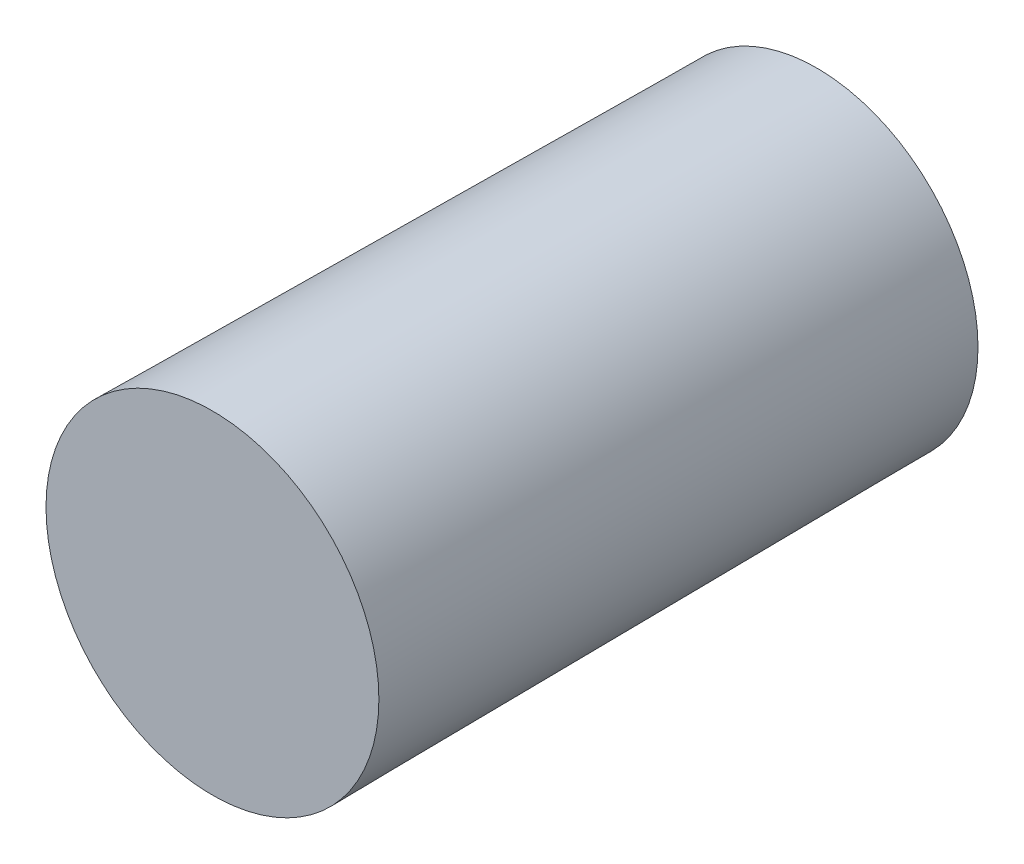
SolidWorks part; units mm, degrees
ref_plane "Face" through (0, 0, 0) normal (0, 0, 1) x (1, 0, 0)
ref_plane "Dessus" through (0, 0, 0) normal (0, 1, 0) x (1, 0, 0)
ref_plane "Droite" through (0, 0, 0) normal (1, 0, 0) x (0, 0, -1)
sketch "Esquisse1" plane through (0, 0, 0) normal (0, 0, 1) x (1, 0, 0)
  circle A0 centre (0, 0) radius 4
  dimension "D1" = 8
extrude "Extrusion1" add sketch "Esquisse1" along normal blind 15 draft 0.5
